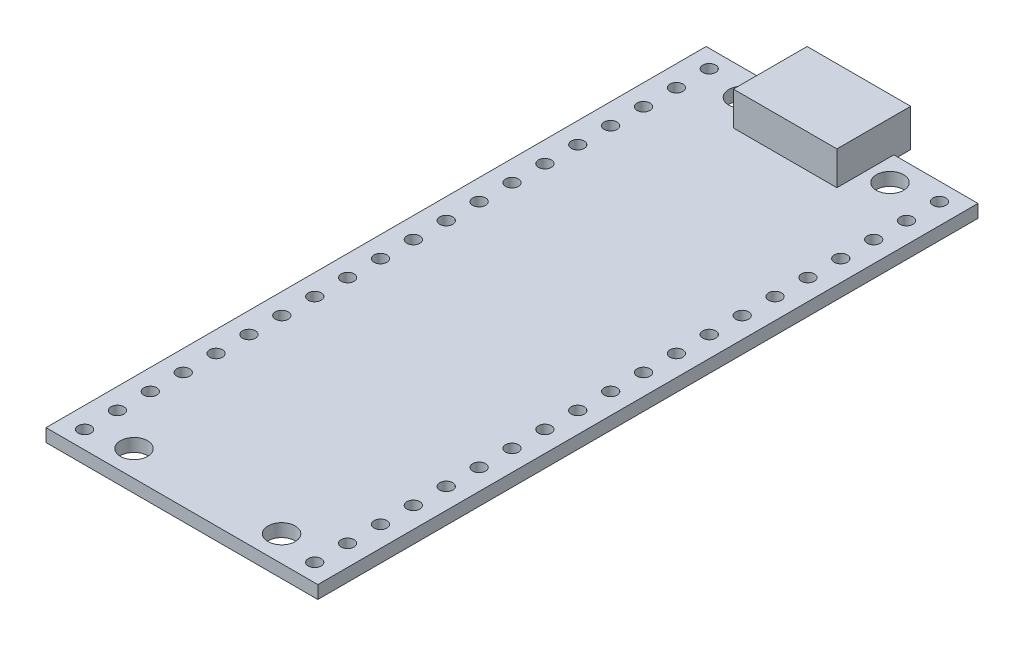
SolidWorks part; units mm, degrees
ref_plane "Front" through (0, 0, 0) normal (0, 0, 1) x (1, 0, 0)
ref_plane "Top" through (0, 0, 0) normal (0, 1, 0) x (1, 0, 0)
ref_plane "Right" through (0, 0, 0) normal (1, 0, 0) x (0, 0, -1)
sketch "Sketch1" plane through (0, 0, 0) normal (0, 1, 0) x (1, 0, 0)
  line L0 (-10.5, -25.5) -> (10.5, 25.5) construction
  line L1 (-10.5, -25.5) -> (10.5, -25.5)
  line L2 (-10.5, -25.5) -> (-10.5, 25.5)
  line L3 (-10.5, 25.5) -> (10.5, 25.5)
  line L4 (10.5, -25.5) -> (10.5, 25.5)
  dimension "D1" = 21
  dimension "D2" = 51
extrude "Boss-Extrude1" add sketch "Sketch1" along normal blind 1
sketch "Sketch2" plane through (0, 1, 0) normal (0, 1, 0) x (1, 0, 0)
  line L0 (-10.5, 25.5) -> (-10.5, -25.5) construction
  line L1 (10.5, 25.5) -> (-10.5, 25.5) construction
  line L2 (-10.5, -25.5) -> (10.5, -25.5) construction
  line L3 (10.5, -25.5) -> (10.5, 25.5) construction
  circle A0 centre (-5.7, -23.5) radius 1.05
  circle A1 centre (5.7, -23.5) radius 1.05
  circle A2 centre (-5.7, 23.5) radius 1.05
  circle A3 centre (5.7, 23.5) radius 1.05
  dimension "D1" = 2.1
  dimension "D2" = 11.4
  dimension "D3" = 4.8
  dimension "D4" = 2
  dimension "D5" = 2
  dimension "D6" = 4.8
extrude "mounting holes" cut sketch "Sketch2" against normal up to next
sketch "Sketch3" plane through (0, 1, 0) normal (0, 1, 0) x (1, 0, 0)
  line L0 (10.5, 25.5) -> (-10.5, 25.5) construction
  line L1 (-4, 26.8) -> (4, 26.8)
  line L2 (-4, 26.8) -> (-4, 21.1)
  line L3 (-4, 21.1) -> (4, 21.1)
  line L4 (4, 26.8) -> (4, 21.1)
  line L5 (0, 0) -> (0, 21.1) construction
  dimension "D1" = 8
  dimension "D2" = 1.3
  dimension "D3" = 5.7
extrude "micro-USB outline" add sketch "Sketch3" along normal blind 2.6 and the other way blind 0.3
sketch "Sketch4" plane through (0, 1, 0) normal (0, 1, 0) x (1, 0, 0)
  line L0 (0, 0) -> (0, 32.9533) construction
  line L1 (0, 0) -> (-10.5, 0) construction
  line L2 (-10.5, 25.5) -> (-10.5, -25.5) construction
  circle A0 centre (-8.89, 24.13) radius 0.5
  dimension "D1" = 1
  dimension "D2" = 17.78
  dimension "D3" = 48.26
extrude "pin 1 hole" cut sketch "Sketch4" against normal through all
pattern_linear "edge pins" count 20 spacing 2.54 along (0, 0, 1) count 2 spacing 17.78 along (1, 0, 0) of "pin 1 hole"
